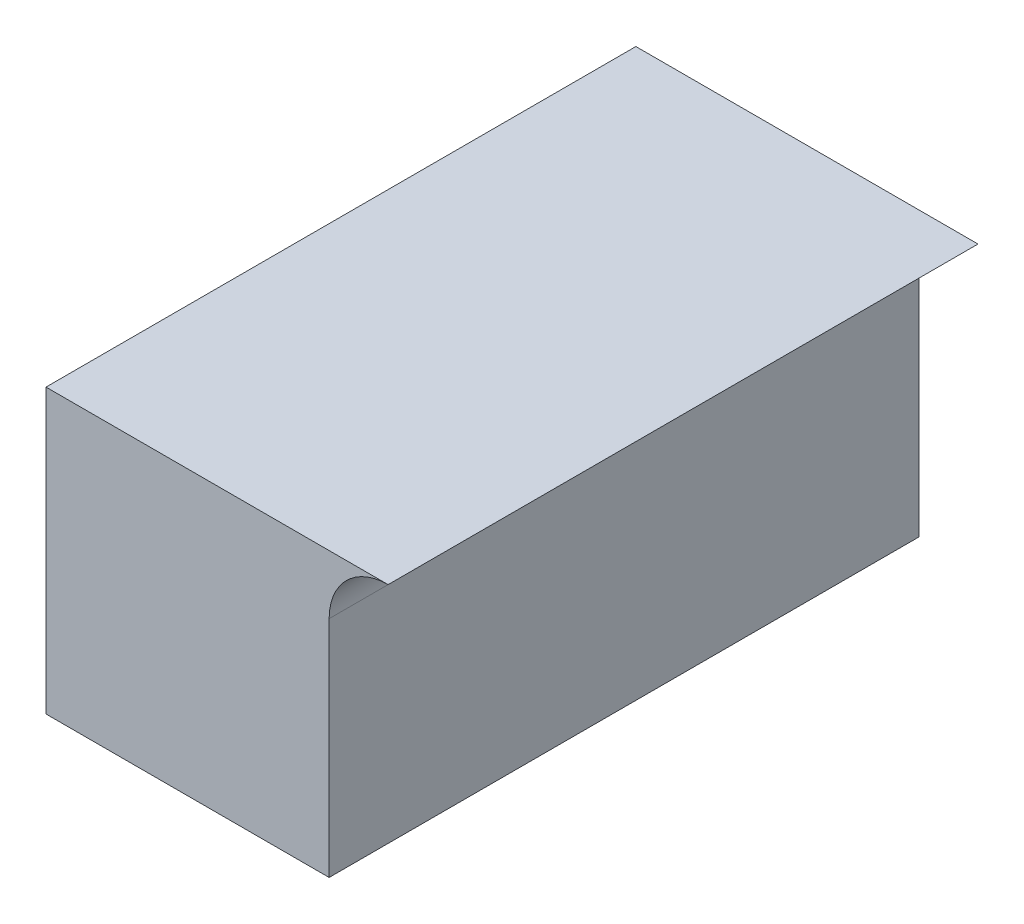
SolidWorks part; units mm, degrees
ref_plane "Plane1" through (0, 0, 0) normal (0, 0, 1) x (1, 0, 0)
ref_plane "Plane2" through (0, 0, 0) normal (0, 1, 0) x (1, 0, 0)
ref_plane "Plane3" through (0, 0, 0) normal (1, 0, 0) x (0, 0, -1)
sketch "Sketch1" plane through (0, 0, 0) normal (0, 0, 1) x (1, 0, 0)
  line L0 (-25, 5) -> (25, 5)
  line L1 (-25, 5) -> (-25, 0)
  line L2 (25, 0) -> (-25, 0)
  line L3 (25, 0) -> (25, 5)
  line L4 (0, 5) -> (0, 0) construction
  line L5 (50, 0) -> (-50, 0) construction
  dimension "D1" = 50
  dimension "D2" = 5
extrude "Base-Extrude" add sketch "Sketch1" along normal mid plane 50
sketch "Lance Tool sketch" plane through (0, 0, 0) normal (0, 0, 1) x (1, 0, 0)
  line L0 (6, 0) -> (-6, 0)
  line L1 (6, 0) -> (6, -12)
  line L2 (-6, -12) -> (6, -12)
  line L3 (-6, -12) -> (-6, 0)
  line L4 (25, 0) -> (-25, 0) construction
  line L5 (0, 0) -> (0, -12) construction
  dimension "Height from Drop Face" = 12
extrude "Lance Tool" add sketch "Lance Tool sketch" along normal mid plane 25
fillet "Fillet" radius 2.5 1 edges at (6, 0, 0)
sketch "Sketch3" plane through (25, 0, 0) normal (1, 0, 0) x (0, 0, -1)
  line L4 (25, 5) -> (-25, 5)
  line L5 (-25, 5) -> (-25, 0)
  line L6 (-25, 0) -> (25, 0)
  line L7 (25, 0) -> (25, 5)
  line L8 (25, 5) -> (-25, 5)
  line L9 (-25, 5) -> (-25, 0)
  line L10 (-25, 0) -> (25, 0)
  line L11 (25, 0) -> (25, 5)
  dimension "D1" = 0
extrude "Cut-Extrude1" cut sketch "Sketch3" against normal through all
sketch "Orientation sketch" plane through (0, 0, 0) normal (0, 1, 0) x (-1, 0, 0)
  line L4 (6, 12.5) -> (6, -12.5)
  line L5 (-8.5, 12.5) -> (6, 12.5)
  line L6 (-8.5, 12.5) -> (-8.5, -12.5)
  line L7 (-8.5, -12.5) -> (6, -12.5)
  line L8 (6, 12.5) -> (6, -12.5)
  line L9 (-8.5, 12.5) -> (6, 12.5)
  line L10 (-8.5, 12.5) -> (-8.5, -12.5)
  line L11 (-8.5, -12.5) -> (6, -12.5)
  dimension "D1" = 0
